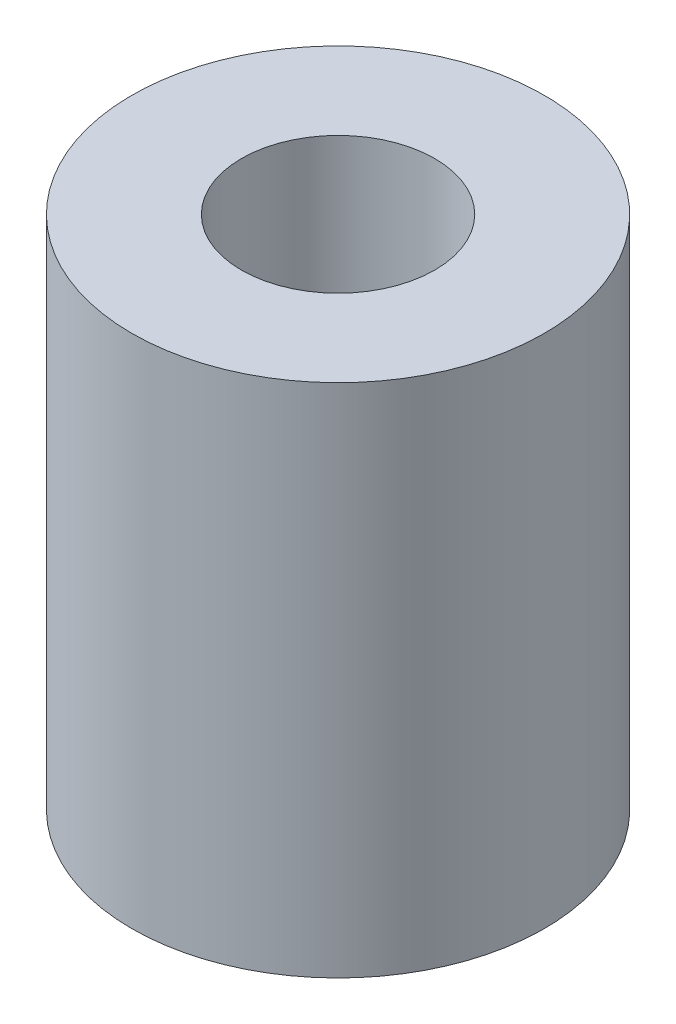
SolidWorks part; units mm, degrees
ref_plane "Front Plane" through (0, 0, 0) normal (0, 0, 1) x (1, 0, 0)
ref_plane "Top Plane" through (0, 0, 0) normal (0, 1, 0) x (1, 0, 0)
ref_plane "Right Plane" through (0, 0, 0) normal (1, 0, 0) x (0, 0, -1)
sketch "Sketch1" plane through (0, 0, 0) normal (0, 1, 0) x (1, 0, 0)
  circle A0 centre (0, 0) radius 2.3813
  circle A1 centre (0, 0) radius 5.08
  dimension "D1" = 4.7625
  dimension "D2" = 10.16
extrude "Boss-Extrude1" add sketch "Sketch1" along normal blind 12.7
